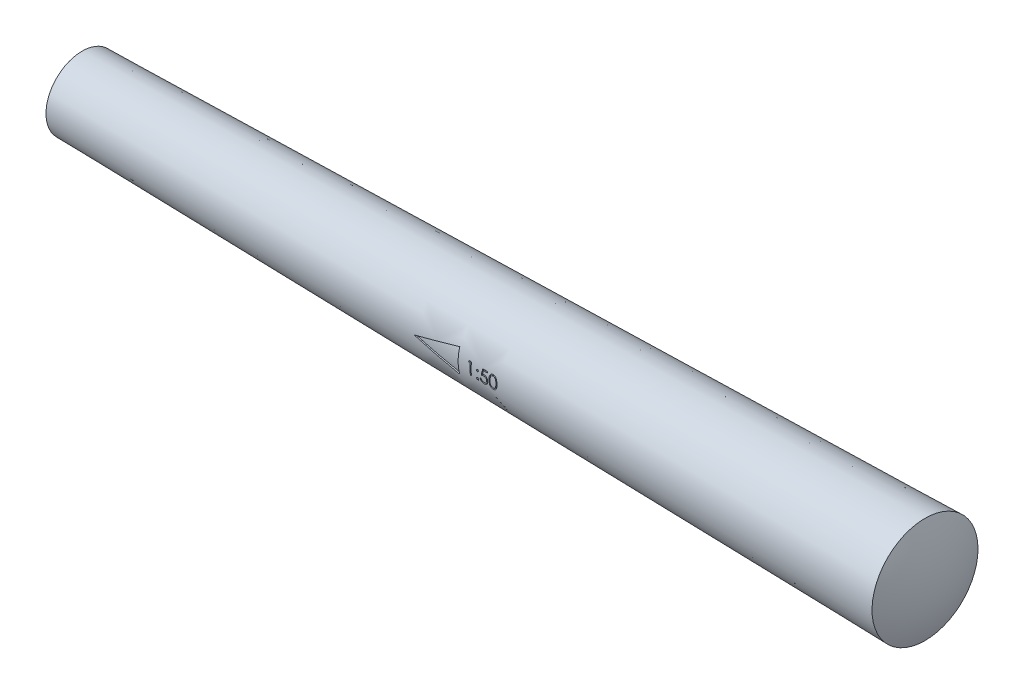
SolidWorks part; units mm, degrees
ref_plane "Front Plane" through (0, 0, 0) normal (0, 0, 1) x (1, 0, 0)
ref_plane "Top Plane" through (0, 0, 0) normal (0, 1, 0) x (1, 0, 0)
ref_plane "Right Plane" through (0, 0, 0) normal (1, 0, 0) x (0, 0, -1)
sketch "Sketch1" plane through (0, 0, 0) normal (1, 0, 0) x (0, 0, -1)
  circle A0 centre (0, 0) radius 3
  dimension "D1" = 6
extrude "Extrude1" add sketch "Sketch1" along normal mid plane 70
draft "Draft1" type of draft neutral plane draft angle 1.146 faces to draft 1 parameters "D1"=1.146
sketch "Sketch2" plane through (0, 0, 0) normal (0, 0, 1) x (1, 0, 0)
  line L0 (-35, 0) -> (-35, 3)
  line L1 (-35, 3) -> (-35, -3) construction
  line L2 (-35, 0) -> (-35.9, 0)
  line L3 (-35.9, 0) -> (-35.9, -3.7) construction
  line L4 (35, 0) -> (35, 4.4)
  line L5 (35, -4.4) -> (35, 4.4) construction
  line L6 (35, 0) -> (35.9, 0)
  line L7 (35.9, 0) -> (35.9, -3.7) construction
  line L8 (-35, -3) -> (35, -4.4) construction
  arc A0 (-35.9, 0) -> (-35, 3) centre (-30.45, 0) cw
  arc A1 (35.9, 0) -> (35, 4.4) centre (24.6942, 0) ccw
  point P14 (0, -3.7)
revolve "Revolve1" add sketch "Sketch2" angle 360 about L2
sketch "Sketch5" plane through (0, 0, 0) normal (0, 0, 1) x (1, 0, 0)
  line L0 (0, 3.7) -> (0, -3.7) construction
  line L1 (35, 4.4) -> (-35, 3) construction
  line L2 (-35, -3) -> (35, -4.4) construction
ref_plane "Plane2" through (0, 0, 0) normal (-0.02, 0, 0.9998) x (0.9998, 0, 0.02)
sketch "Sketch6" plane through (0, 0, 0) normal (-0.02, 0, 0.9998) x (0.9998, 0, 0.02)
  line L0 (0, 0) -> (0, 1)
  line L1 (0, 3.7) -> (0, -3.7) construction
  line L2 (0, 1) -> (-3.7321, 0)
  line L3 (-3.7321, 0) -> (0, -1)
  line L4 (0, -1) -> (0, 0)
  line L5 (0, -0.5) -> (4, -0.5) construction
  text T0 "1:50" font "Century Gothic" height 1
  dimension "D1" = 2
  dimension "D2" = 30
  dimension "D3" = 4
wrap "Wrap2" sketch "Sketch6" wrap type deboss source sketch "Sketch6" thickness 0.1 parameters "D1"=0.1
equation "\"D2@Sketch2\" = \"D1@Sketch2\""
